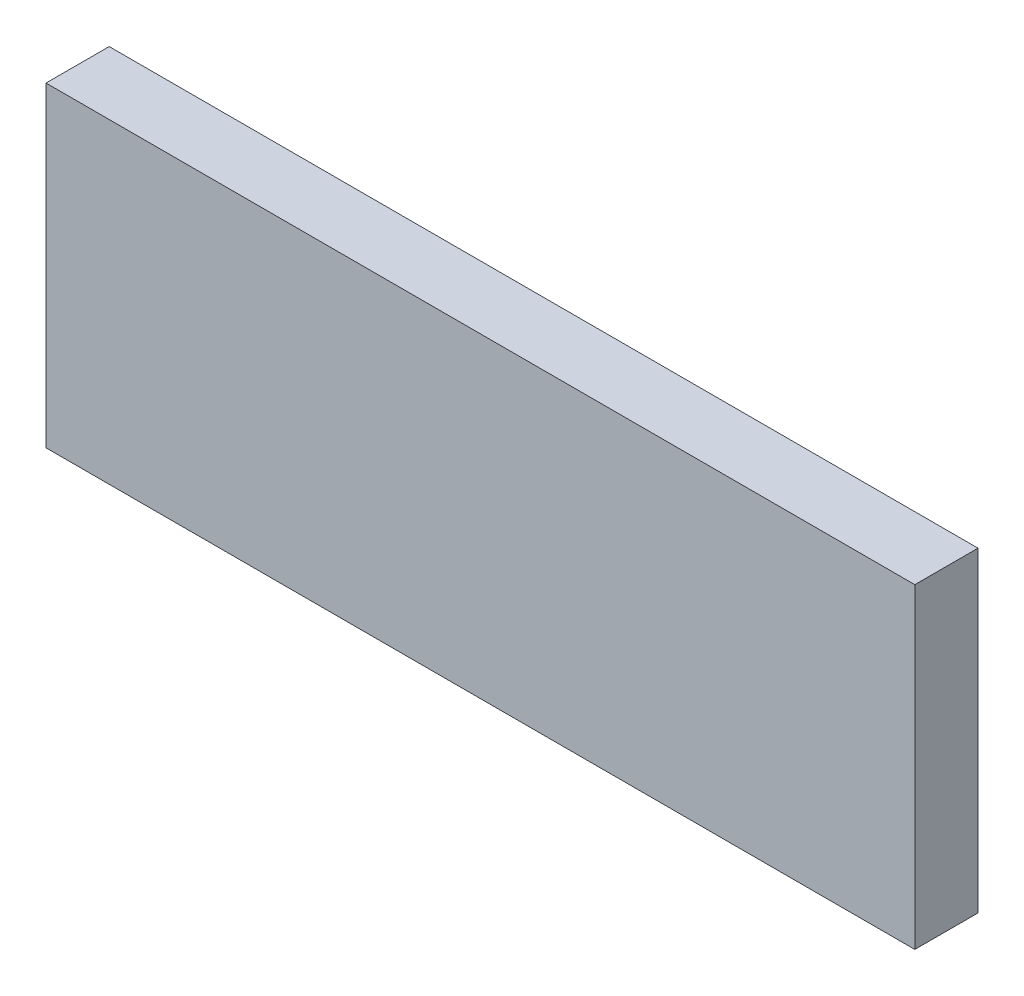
SolidWorks part; units mm, degrees
ref_plane "Plan de face" through (0, 0, 0) normal (0, 0, 1) x (1, 0, 0)
ref_plane "Plan de dessus" through (0, 0, 0) normal (0, 1, 0) x (1, 0, 0)
ref_plane "Plan de droite" through (0, 0, 0) normal (1, 0, 0) x (0, 0, -1)
sketch "Esquisse1" plane through (0, 0, 0) normal (0, 0, 1) x (1, 0, 0)
  line L1 (0, 0) -> (110, 0)
  line L2 (0, 0) -> (0, 40)
  line L3 (0, 40) -> (110, 40)
  line L4 (110, 0) -> (110, 40)
  dimension "D1" = 110
  dimension "D2" = 40
extrude "Extrusion1" add sketch "Esquisse1" along normal blind 8
